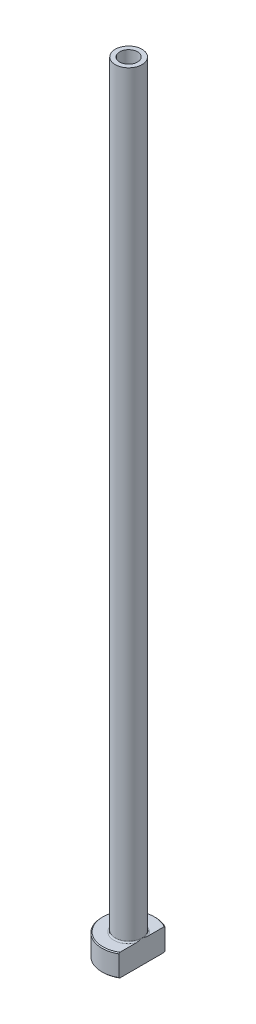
SolidWorks part; units mm, degrees
ref_plane "Front Plane" through (0, 0, 0) normal (0, 0, 1) x (1, 0, 0)
ref_plane "Top Plane" through (0, 0, 0) normal (0, 1, 0) x (1, 0, 0)
ref_plane "Right Plane" through (0, 0, 0) normal (1, 0, 0) x (0, 0, -1)
sketch "Sketch1" plane through (0, 0, 0) normal (0, 0, 1) x (1, 0, 0)
  line L0 (-2, 175) -> (-3, 175)
  line L1 (-3, 175) -> (-3, 5)
  line L2 (-3, 5) -> (-6, 5)
  line L3 (-6, 5) -> (-6, 0)
  line L4 (4.95, 0) -> (-4.95, 0) construction
  line L5 (-6, 0) -> (-2.25, 0)
  line L6 (-2, 130) -> (-2, 175)
  line L7 (0, 92.1877) -> (0, -15.5353) construction
  line L8 (0, -6.6) -> (0, 6.6) construction
  line L9 (-2, 130) -> (-2.25, 118)
  line L10 (-2.25, 118) -> (-2.25, 0)
  dimension "D1" = 0.25
  dimension "ID" = 4
  dimension "OD" = 6
  dimension "L" = 175
  dimension "H" = 12
  dimension "T" = 5
  dimension "N" = 45
  dimension "D2" = 12
  dimension "L-N" = 130
revolve "Revolve1" add sketch "Sketch1" angle 360 about L7
fillet "Fillet1" radius 0.3 1 edges at (0, 5, 3)
chamfer "Chamfer1" distance 0.2 angle 45 2 edges at (0, 5, 6) (0, 0, 6)
sketch "Sketch2" plane through (0, 0, 0) normal (0, -1, 0) x (1, 0, 0)
  line L0 (3, 5.1962) -> (3, -5.1962)
  circle A0 centre (0, 0) radius 6 construction
  arc A1 (3, 5.1962) -> (3, -5.1962) centre (0, 0) cw
  circle A2 centre (0, 0) radius 3 construction
extrude "Cut-Extrude1" cut sketch "Sketch2" against normal through all
chamfer "Chamfer2" distance 0.5 angle 45 1 edges at (0, 0, 2.25)
